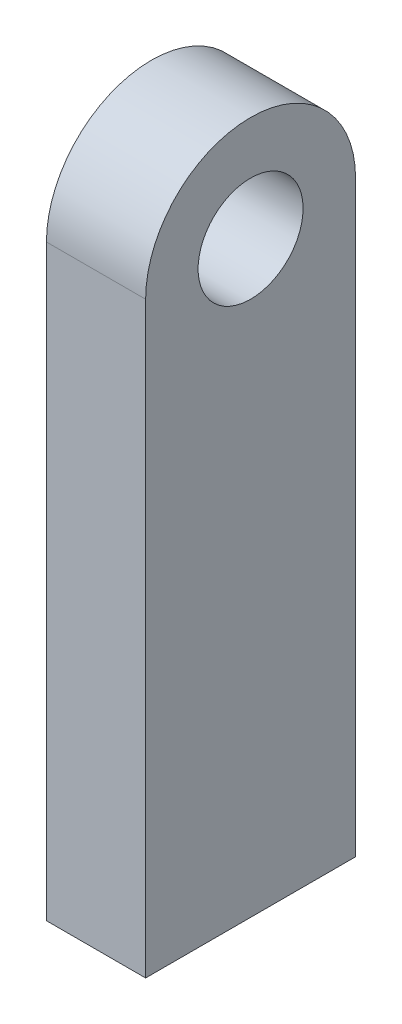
SolidWorks part; units mm, degrees
ref_plane "Front Plane" through (0, 0, 0) normal (0, 0, 1) x (1, 0, 0)
ref_plane "Top Plane" through (0, 0, 0) normal (0, 1, 0) x (1, 0, 0)
ref_plane "Right Plane" through (0, 0, 0) normal (1, 0, 0) x (0, 0, -1)
sketch "Sketch3" plane through (0, 0, 0) normal (1, 0, 0) x (0, 0, -1)
  line L1 (-6.35, 0) -> (6.35, 0)
  line L2 (-6.35, 0) -> (-6.35, -35.56)
  line L3 (-6.35, -35.56) -> (6.35, -35.56)
  line L4 (6.35, 0) -> (6.35, -35.56)
  arc A0 (6.35, 0) -> (-6.35, 0) centre (0, 0) ccw
  circle A1 centre (0, 0) radius 3.175
  point P6 (0, 0)
  point P8 (-0.3854, -2.1785)
  point P9 (-3.8242, -1.1792)
  point P10 (0, 0)
extrude "Boss-Extrude2" add sketch "Sketch3" along normal blind 6 contours A1 L1 L2 L3 L4 | A1 L1 A0
equation "\"dowel thick\"= 1 / 4"
equation "\"height\"= 1.4"
equation "\"ply thick\"= 6mm"
equation "\"D1@Sketch3\"=\"dowel thick\""
equation "\"D2@Sketch3\"=\"dowel thick\"*2"
equation "\"D3@Sketch3\"=\"height\""
equation "\"D1@Boss-Extrude2\"=\"ply thick\""
